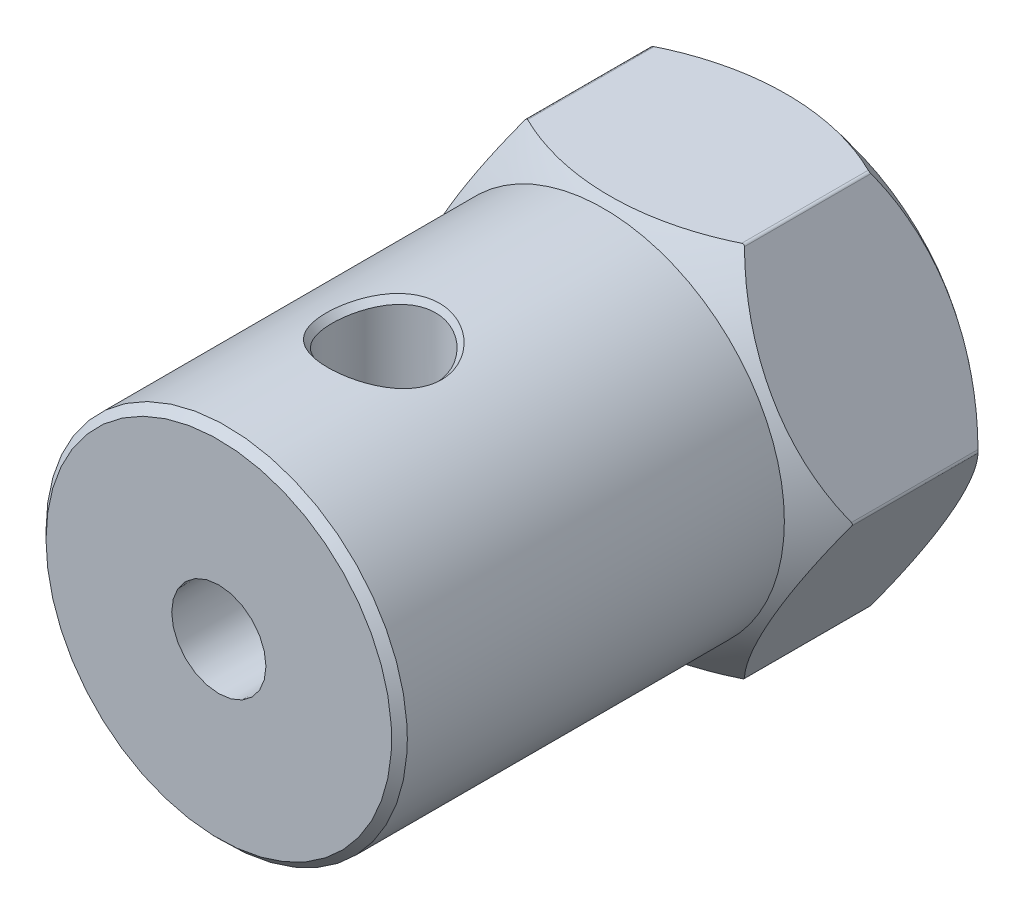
SolidWorks part; units mm, degrees
ref_plane "前视基准面" through (0, 0, 0) normal (0, 0, 1) x (1, 0, 0)
ref_plane "上视基准面" through (0, 0, 0) normal (0, 1, 0) x (1, 0, 0)
ref_plane "右视基准面" through (0, 0, 0) normal (1, 0, 0) x (0, 0, -1)
other "Configuration Table"
sketch "草图1" plane through (0, 0, 0) normal (0, 0, 1) x (1, 0, 0)
  line L1 (3.4064, 6) -> (-3.4064, 6)
  line L2 (-3.493, 5.95) -> (-6.8993, 0.05)
  line L3 (-6.8993, -0.05) -> (-3.493, -5.95)
  line L4 (-3.4064, -6) -> (3.4064, -6)
  line L5 (3.493, -5.95) -> (6.8993, -0.05)
  line L6 (6.8993, 0.05) -> (3.493, 5.95)
  circle A0 centre (0, 0) radius 1.65
  circle A1 centre (0, 0) radius 6 construction
  arc A2 (6.8993, -0.05) -> (6.8993, 0.05) centre (6.8127, 0) ccw
  arc A3 (3.4064, -6) -> (3.493, -5.95) centre (3.4064, -5.9) ccw
  arc A4 (-3.493, -5.95) -> (-3.4064, -6) centre (-3.4064, -5.9) ccw
  arc A5 (-6.8993, 0.05) -> (-6.8993, -0.05) centre (-6.8127, 0) ccw
  arc A6 (-3.4064, 6) -> (-3.493, 5.95) centre (-3.4064, 5.9) ccw
  arc A7 (3.4064, 6) -> (3.493, 5.95) centre (3.4064, 5.9) cw
  dimension "D1" = 3.3
  dimension "D3" = 0.1
  dimension "D2" = 12
extrude "凸台-拉伸1" add sketch "草图1" along normal blind 18.25
sketch "草图2" plane through (0, 0, 0) normal (0, 1, 0) x (1, 0, 0)
  line L0 (-3.493, 0) -> (-6.8993, 0) construction
  line L1 (-6.9127, 0) -> (-6.9127, -18.25) construction
  line L2 (-7.9127, -3) -> (0, -3) construction
  line L3 (-5.75, -6) -> (-5.75, -20)
  line L4 (-5.75, -20) -> (-7.9127, -20)
  line L5 (-7.9127, -20) -> (-7.9127, -5)
  line L6 (-7.9127, -5) -> (-6.9127, -5)
  line L7 (-5.75, 0) -> (-7.9127, 0)
  line L8 (-7.9127, 0) -> (-7.9127, -1)
  line L9 (-7.9127, -1) -> (-6.9127, -1)
  line L15 (0, 0) -> (0, -21.1927) construction
  arc A0 (-5.75, 0) -> (-6.9127, -1) centre (0.17, -8.0594) ccw
  arc A1 (-5.75, -6) -> (-6.9127, -5) centre (0.17, 2.0594) cw
  dimension "D6" = 10
  dimension "D1" = 3
  dimension "D2" = 5.75
  dimension "D3" = 4
  dimension "D4" = 1
  dimension "D5" = 15
revolve "切除-旋转1" cut sketch "草图2" angle 360 about L15
sketch "草图3" plane through (0, 0, 18.25) normal (0, 0, 1) x (1, 0, 0)
  circle A0 centre (0, 0) radius 1.65
  circle A1 centre (0, 0) radius 1.5
  circle A2 centre (0, 0) radius 1.65 construction
  dimension "D1" = 3
extrude "凸台-拉伸2" add sketch "草图3" against normal offset from surface (12.25 mm away) 6
sketch "草图4" plane through (0, 0, 0) normal (0, 1, 0) x (1, 0, 0)
  line L0 (0, 0) -> (0, -13) construction
  circle A0 centre (0, -13) radius 1.65
  dimension "D1" = 3.3
  dimension "D2" = 13
extrude "切除-拉伸1" cut sketch "草图4" against normal through all both and the other way through all
chamfer "倒角1" distance 0.25 angle 45 4 edges at (1.65, 0, 0) (-0.3053, -5.7419, 11.3785) (0.3053, 5.7419, 11.3785) (5.75, 0, 18.25)
